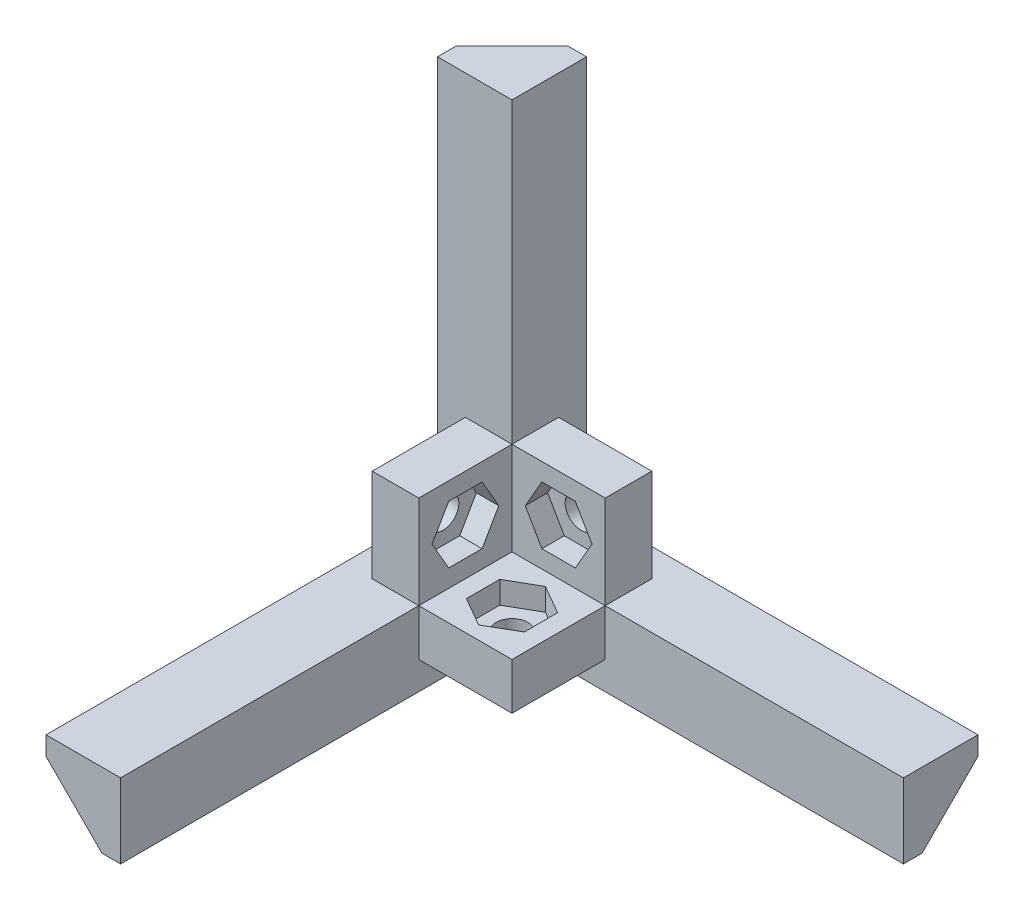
SolidWorks part; units mm, degrees
ref_plane "Piano frontale" through (0, 0, 0) normal (0, 0, 1) x (1, 0, 0)
ref_plane "Piano superiore" through (0, 0, 0) normal (0, 1, 0) x (1, 0, 0)
ref_plane "Piano destro" through (0, 0, 0) normal (1, 0, 0) x (0, 0, -1)
sketch "Sketch1" plane through (0, 0, 0) normal (0, 0, 1) x (1, 0, 0)
  line L0 (0, 0) -> (0, 42)
  line L1 (0, 42) -> (-8, 42)
  line L2 (-8, 42) -> (-8, -8)
  line L3 (-8, -8) -> (42, -8)
  line L4 (42, -8) -> (42, 0)
  line L5 (42, 0) -> (0, 0)
  dimension "D1" = 50
  dimension "D2" = 8
extrude "Boss-Extrude1" add sketch "Sketch1" along normal blind 8
sketch "Sketch2" plane through (0, 0, 8) normal (0, 0, 1) x (1, 0, 0)
  line L0 (0, 0) -> (-8, 0)
  line L1 (-8, 42) -> (-8, -8) construction
  line L2 (-8, 0) -> (-8, -8)
  line L3 (-8, -8) -> (0, -8)
  line L4 (-8, -8) -> (42, -8) construction
  line L5 (0, -8) -> (0, 0)
extrude "Boss-Extrude2" add sketch "Sketch2" along normal blind 42
sketch "Sketch3" plane through (0, 0, 8) normal (0, 0, 1) x (1, 0, 0)
  line L0 (0, 0) -> (10, 0)
  line L1 (42, 0) -> (0, 0) construction
  line L2 (10, 0) -> (10, -5)
  line L3 (10, -5) -> (0, -5)
  line L4 (0, -8) -> (0, 0) construction
  line L5 (0, -5) -> (0, 0)
  dimension "D1" = 5
  dimension "D2" = 10
extrude "Boss-Extrude3" add sketch "Sketch3" along normal blind 10
sketch "Sketch4" plane through (0, -5, 0) normal (0, -1, 0) x (1, 0, 0)
  line L0 (0, 18) -> (10, 18) construction
  line L1 (10, 18) -> (10, 8) construction
  circle A0 centre (5, 13) radius 1.7
  point P2 (0, 0)
  point P5 (5, 18)
  point P6 (0, 0)
  point P9 (10, 13)
  dimension "D1" = 3.4
extrude "Cut-Extrude1" cut sketch "Sketch4" against normal up to next
sketch "Sketch5" plane through (0, 0, 0) normal (0, 1, 0) x (1, 0, 0)
  line L1 (8.5796, -13) -> (6.7898, -9.9)
  line L2 (6.7898, -9.9) -> (3.2102, -9.9)
  line L3 (3.2102, -9.9) -> (1.4204, -13)
  line L4 (1.4204, -13) -> (3.2102, -16.1)
  line L5 (3.2102, -16.1) -> (6.7898, -16.1)
  line L6 (6.7898, -16.1) -> (8.5796, -13)
  circle A0 centre (5, -13) radius 3.1 construction
  point P1 (0, 0)
  dimension "D1" = 6.2
extrude "Cut-Extrude2" cut sketch "Sketch5" against normal blind 2.4
ref_plane "Plane1" through (0, -4, 4) normal (0, 0.7071, -0.7071) x (-1, 0, 0)
mirror "Mirror1" about plane through (0, -4, 4) normal (0, 0.7071, -0.7071) of "Cut-Extrude2", "Cut-Extrude1", "Boss-Extrude3"
chamfer "Chamfer1" distance 6 angle 45 3 edges at (-8, 17, 0) (-8, -8, 25) (17, -8, 0)
ref_plane "Plane2" through (-4, 0, 4) normal (0.7071, 0, -0.7071) x (0, 1, 0)
mirror "Mirror2" about plane through (-4, 0, 4) normal (0.7071, 0, -0.7071) of "Mirror1", "Cut-Extrude1", "Cut-Extrude2"
